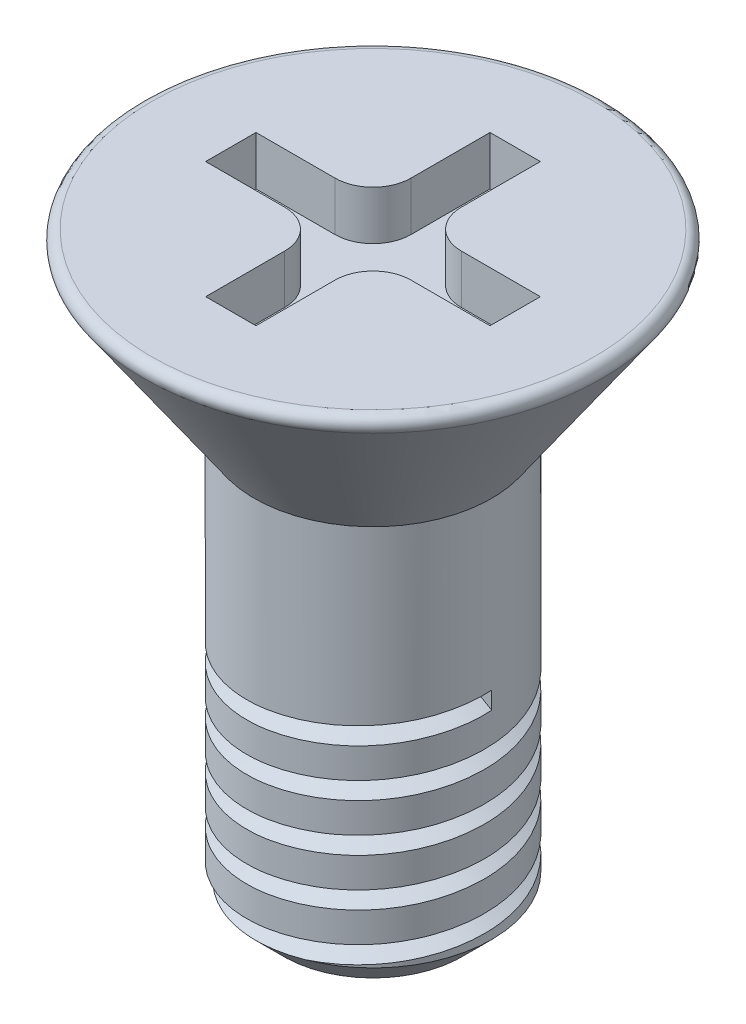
SolidWorks part; units mm, degrees
ref_plane "Front Plane" through (0, 0, 0) normal (0, 0, 1) x (1, 0, 0)
ref_plane "Top Plane" through (0, 0, 0) normal (0, 1, 0) x (1, 0, 0)
ref_plane "Right Plane" through (0, 0, 0) normal (1, 0, 0) x (0, 0, -1)
sketch "Sketch1" plane through (0, 0, 0) normal (0, 0, 1) x (1, 0, 0)
  line B0 (1.6163, -7.447) -> (4.7973, -7.447) construction
  line B1 (1.6163, -6.812) -> (4.7973, -6.812) construction
  line B2 (1.6163, -6.177) -> (4.7973, -6.177) construction
  line B3 (1.6163, -5.542) -> (4.7973, -5.542) construction
  line B4 (4.7973, -2.3294) -> (6.4136, 0) construction
  line B5 (4.7973, -7.4481) -> (4.7973, -2.3294) construction
  line B6 (1.6163, -2.3294) -> (1.6163, -7.4481)
  line B7 (4.7973, -2.3294) -> (1.6163, -2.3294) construction
  line B8 (2.8695, -0.6553) -> (3.544, -0.6553) construction
  line B9 (3.544, -0.6553) -> (3.544, 0) construction
  line B10 (2.8695, 0) -> (2.8695, -0.6553) construction
  line B11 (1.6163, -2.3294) -> (0, 0)
  line B12 (1.6163, -4.907) -> (4.7973, -4.907) construction
  line B13 (2.0139, -7.8457) -> (4.3997, -7.8457) construction
  line B14 (4.3997, -4.907) -> (4.3997, -7.447) construction
  line B15 (4.3997, -7.8457) -> (4.7973, -7.4481) construction
  line B16 (2.0139, -4.907) -> (2.0139, -7.447) construction
  line B17 (1.6163, -7.4481) -> (2.0139, -7.8457)
  line B18 (0, 0) -> (3.2068, 0)
  line B19 (3.2068, 0) -> (3.2068, -7.8457)
  line B20 (3.2068, -7.8457) -> (2.0139, -7.8457)
sketch_block_instance "screw-.1875-2_0-1"
sketch_block "screw-.1875-2_0"
revolve "Revolve1" add sketch "Sketch1" angle 360 about L19
sketch "Sketch2" plane through (0, 0, 0) normal (0, 0, 1) x (1, 0, 0)
  line L0 (3.544, -0.6553) -> (3.544, 0) construction
  line L1 (3.544, -0.6553) -> (3.544, 0)
  line L2 (2.8695, -0.6553) -> (3.544, -0.6553) construction
  line L3 (2.8695, -0.6553) -> (3.544, -0.6553)
  line L4 (2.8695, 0) -> (2.8695, -0.6553) construction
  line L5 (2.8695, 0) -> (2.8695, -0.6553)
  line L7 (6.4136, 0) -> (0, 0) construction
  line L8 (3.544, 0) -> (2.8695, 0)
extrude "Cut-Extrude1" cut sketch "Sketch2" against normal mid plane 3.81
sketch "Sketch3" plane through (0, -7.8457, 0) normal (0, -1, 0) x (1, 0, 0)
  circle A0 centre (3.2068, 0) radius 1.5905 construction
  circle A1 centre (3.2068, 0) radius 1.5905
curve "Helix/Spiral1"
sketch "Sketch4" plane through (0, 0, 0) normal (0, 0, 1) x (1, 0, 0)
  line L1 (4.9261, -7.6552) -> (4.9261, -8.0362)
  line L2 (4.9261, -8.0362) -> (4.5941, -7.8457)
  line L3 (4.5941, -7.8457) -> (4.9261, -7.6552)
  line L4 (4.9261, -7.6552) -> (4.7973, -7.8457) construction
  line L6 (4.5941, -7.8457) -> (4.9261, -7.8457) construction
  dimension "D1" = 0.381
  dimension "D2" = 0.332
  dimension "D3" = 0.2032
sweep "Cut-Sweep1" cut profiles "Sketch4" path "Helix/Spiral1"
pattern_circular "CirPattern1" count 2 over 90 about axis through (3.2068, 0, 0) along (0, 1, 0) of "Cut-Extrude1"
fillet "Fillet1" radius 0.508 4 edges at (3.544, -0.3276, 0.3373) (3.544, -0.3276, -0.3373) (2.8695, -0.3276, -0.3373) (2.8695, -0.3276, 0.3373)
fillet "Fillet2" radius 0.127 1 edges at (0, 0, 0)
